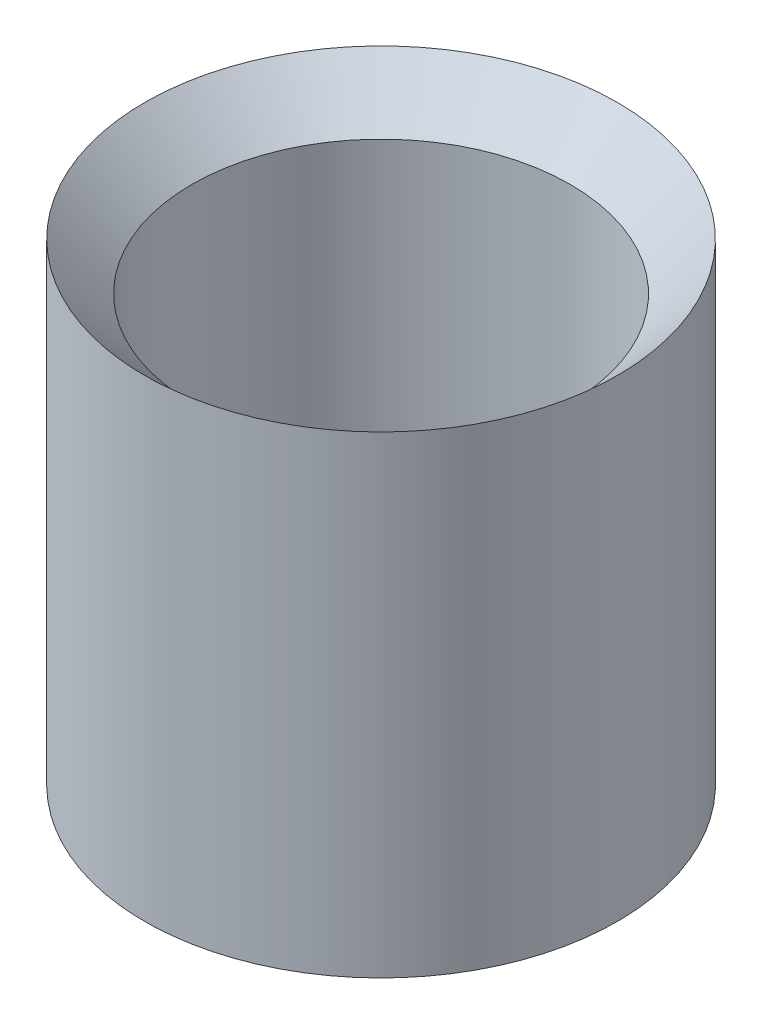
SolidWorks part; units mm, degrees
ref_plane "前视基准面" through (0, 0, 0) normal (0, 0, 1) x (1, 0, 0)
ref_plane "上视基准面" through (0, 0, 0) normal (0, 1, 0) x (1, 0, 0)
ref_plane "右视基准面" through (0, 0, 0) normal (1, 0, 0) x (0, 0, -1)
sketch "Sketch1" plane through (0, 0, 0) normal (0, 0, 1) x (1, 0, 0)
  line L0 (0, -73.0615) -> (0, 75.8716) construction
  line L1 (-50, 0) -> (-50, 100)
  line L2 (-50, 100) -> (-40, 90)
  line L3 (-40, 90) -> (-40, 0)
  line L4 (-40, 0) -> (-50, 0)
  line L5 (-122.4382, 0) -> (68.6457, 0) construction
  dimension "D1" = 80
  dimension "D2" = 100
  dimension "D3" = 90
  dimension "D4" = 100
revolve "Revolve1" add sketch "Sketch1" angle 360 about L0
